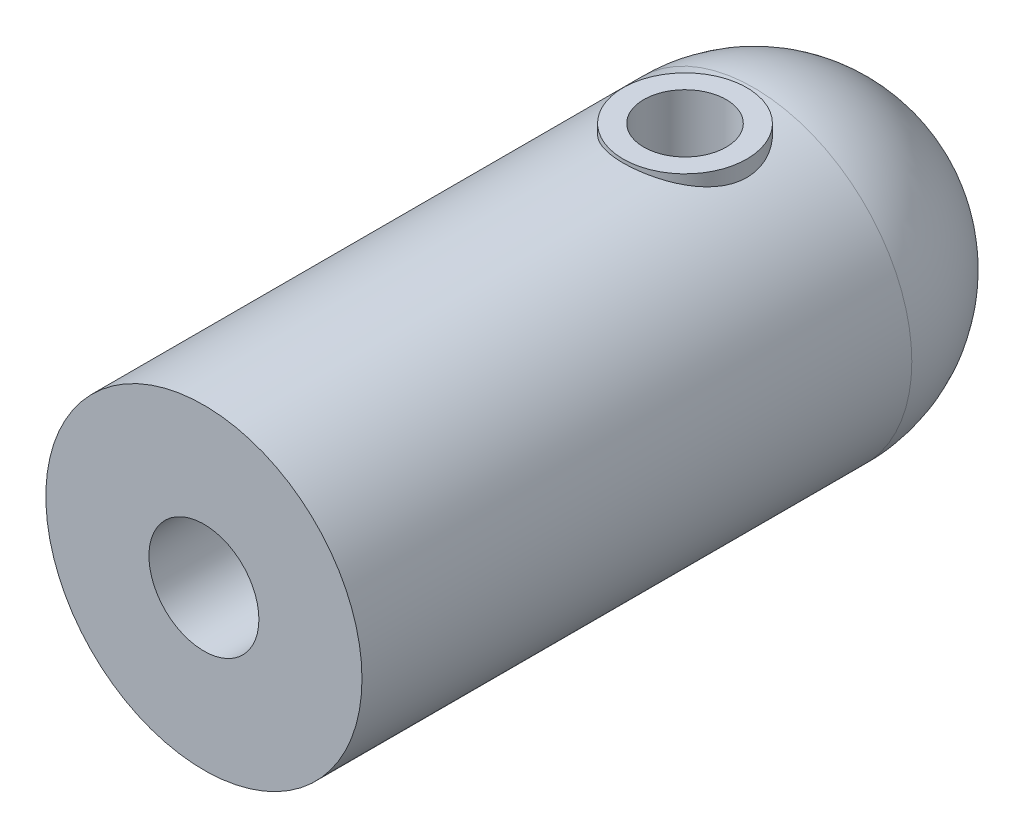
SolidWorks part; units mm, degrees
ref_plane "Plan de face" through (0, 0, 0) normal (0, 0, 1) x (1, 0, 0)
ref_plane "Plan de dessus" through (0, 0, 0) normal (0, 1, 0) x (1, 0, 0)
ref_plane "Plan de droite" through (0, 0, 0) normal (1, 0, 0) x (0, 0, -1)
sketch "Esquisse1" plane through (0, 0, 0) normal (0, 0, 1) x (1, 0, 0)
  circle A0 centre (0, 0) radius 23
  dimension "D2" = 46
extrude "Extrusion1" add sketch "Esquisse1" along normal blind 80
sketch "Esquisse3" plane through (0, 0, 80) normal (0, 0, 1) x (1, 0, 0)
  circle A0 centre (0, 0) radius 8
  dimension "D1" = 16
extrude "Enlèv. mat.-Extru.1" cut sketch "Esquisse3" against normal blind 90
ref_plane "Plan1" through (0, 23.5, 0) normal (0, 1, 0) x (-1, 0, 0)
ref_plane "Plan2" through (0, -23.5, 0) normal (0, 1, 0) x (-1, 0, 0)
sketch "Esquisse4" plane through (0, 23.5, 0) normal (0, 1, 0) x (-1, 0, 0)
  circle A0 centre (0, 10) radius 9
  dimension "D1" = 18
  dimension "D2" = 10
extrude "Extrusion2" add sketch "Esquisse4" against normal up to next
sketch "Esquisse5" plane through (0, -23.5, 0) normal (0, 1, 0) x (-1, 0, 0)
  circle A0 centre (0, 10) radius 9
  dimension "D1" = 18
extrude "Extrusion3" add sketch "Esquisse5" along normal up to next
sketch "Esquisse7" plane through (0, -23.5, 0) normal (0, -1, 0) x (1, 0, 0)
  circle A0 centre (0, 10) radius 6
  dimension "D1" = 12
extrude "Enlèv. mat.-Extru.4" cut sketch "Esquisse7" against normal blind 10
sketch "Esquisse8" plane through (0, 23.5, 0) normal (0, 1, 0) x (-1, 0, 0)
  circle A0 centre (0, 10) radius 6
  dimension "D1" = 12
extrude "Enlèv. mat.-Extru.5" cut sketch "Esquisse8" against normal blind 10
sketch "Esquisse9" plane through (0, 0, 0) normal (0, 1, 0) x (1, 0, 0)
  line L0 (0, -2.0305) -> (0, 31.7953) construction
  line L1 (-23, 0) -> (0, 0)
  line L2 (23, 0) -> (-23, 0) construction
  line L3 (0, 0) -> (0, 23.1697)
  arc A0 (-23, 0) -> (0, 23.1697) centre (0.0849, 0.0849) cw
revolve "Révolution2" add sketch "Esquisse9" angle 360 about L3
